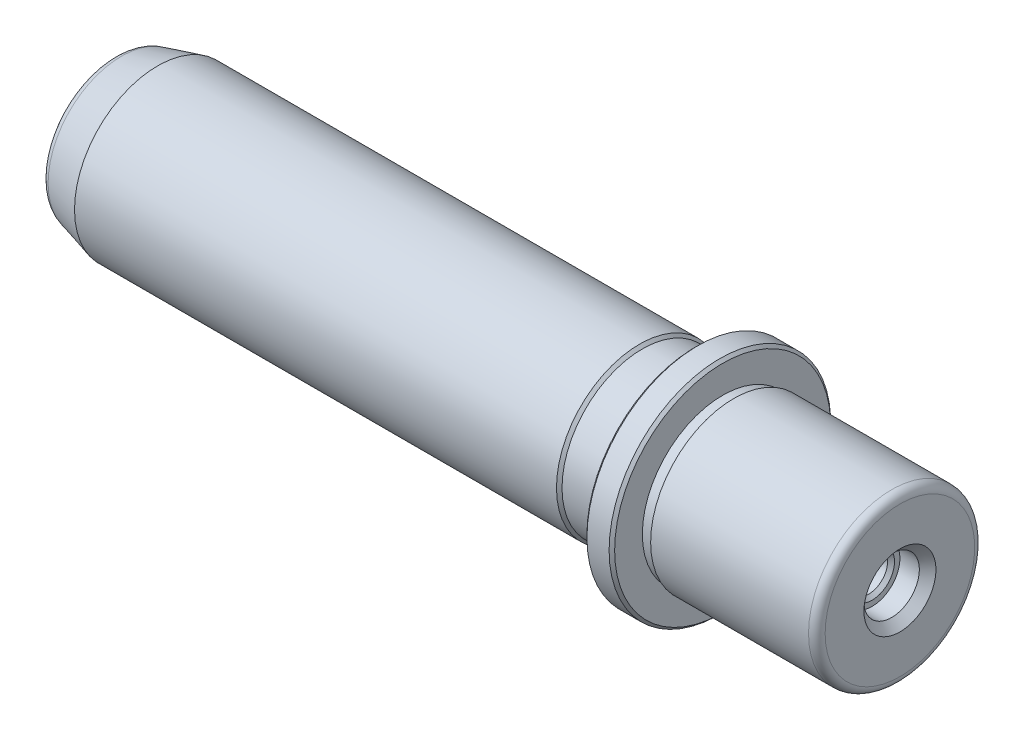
SolidWorks part; units mm, degrees
ref_plane "Plano frontal" through (0, 0, 0) normal (0, 0, 1) x (1, 0, 0)
ref_plane "Plano superior" through (0, 0, 0) normal (0, 1, 0) x (1, 0, 0)
ref_plane "Plano direito" through (0, 0, 0) normal (1, 0, 0) x (0, 0, -1)
sketch "Esboço1" plane through (0, 0, 0) normal (0, 0, 1) x (1, 0, 0)
  line L0 (0, 0) -> (142, 0) construction
  line L1 (0, 6.5) -> (0, 11.3218)
  line L2 (1.4824, 13.2536) -> (8, 15)
  line L3 (8, 15) -> (95, 15)
  line L5 (95.5, 14.5) -> (104.5, 14.5)
  line L7 (105.5, 20) -> (109.5, 20)
  line L8 (110, 19.5) -> (110, 14.5)
  line L10 (142, 13.5) -> (142, 6.5)
  line L12 (140.5, 15) -> (112, 15)
  line L13 (112, 14.5) -> (110, 14.5)
  line L14 (112, 14.5) -> (112, 15)
  line L15 (95, 15) -> (95.5, 14.5)
  line L16 (105, 19.5) -> (105, 15)
  line L17 (104.5, 14.5) -> (105, 15)
  line L18 (5, 0) -> (137, 0)
  line L23 (109.5, 20) -> (110, 19.5)
  line L24 (105.5, 20) -> (105, 19.5)
  line L25 (0, 6.5) -> (1.5, 5)
  line L26 (1.5, 5) -> (5, 5)
  line L27 (5, 5) -> (5, 0)
  line L28 (142, 6.5) -> (140.5, 5)
  line L29 (140.5, 5) -> (137, 5)
  line L30 (137, 5) -> (137, 0)
  arc A0 (0, 11.3218) -> (1.4824, 13.2536) centre (2, 11.3218) cw
  arc A1 (140.5, 15) -> (142, 13.5) centre (140.5, 13.5) cw
  point P10 (105, 20)
  point P11 (110, 20)
  point P24 (0, 12.8564)
  dimension "D13" = 2
  dimension "D18" = 1.5
  dimension "D1" = 142
  dimension "D2" = 30
  dimension "D3" = 8
  dimension "D4" = 15
  dimension "D5" = 10
  dimension "D6" = 29
  dimension "D7" = 40
  dimension "D8" = 45
  dimension "D9" = 45
  dimension "D10" = 5
  dimension "D11" = 110
  dimension "D12" = 2
  dimension "D14" = 5
  dimension "D15" = 5
  dimension "D16" = 45
  dimension "D17" = 5
  dimension "D19" = 1.5
  dimension "D22" = 5
  dimension "D23" = 1.5
  dimension "D24" = 45
revolve "Revolução1" add sketch "Esboço1" angle 360 about L0
hole_wizard "Furo roscado de M8x1.251" positions "3DSketch1" profile "Esboço2" tap size "M8x1.25" standard "Ansi Metric"
sketch3d "3DSketch1"
  circle A0 centre (137, 0, 0) radius 5 construction
  circle A1 centre (5, 0, 0) radius 5 construction
  point P0 (5, 0, 0)
  point P2 (137, 0, 0)
  point P8 (132, 0, 0)
  point P12 (0, 0, 0)
sketch "Esboço2" plane through (5, 0, 0) normal (0, 1, 0) x (0, 0, 1)
  line L0 (0, 0) -> (0, 24.2929)
  line L1 (0, 24.2929) -> (3.4, 22.25)
  line L2 (3.4, 22.25) -> (3.4, 0.625)
  line L3 (3.4, 0.625) -> (4.025, 0)
  line L5 (4.025, 0) -> (0, 0)
  line L6 (-3.4, 0.625) -> (-4.025, 0) construction
  line L10 (0, 24.2929) -> (-3.4, 22.25) construction
  line L11 (0, -6.35) -> (0, 107.95) construction
  dimension "Tap Drill Dia." = 6.8
  dimension "Tap Drill Depth" = 22.25
  dimension "Near C'Sink Dia." = 8.05
  dimension "Near C'Sink Angle" = 90
  dimension "Drill Angle" = 118
